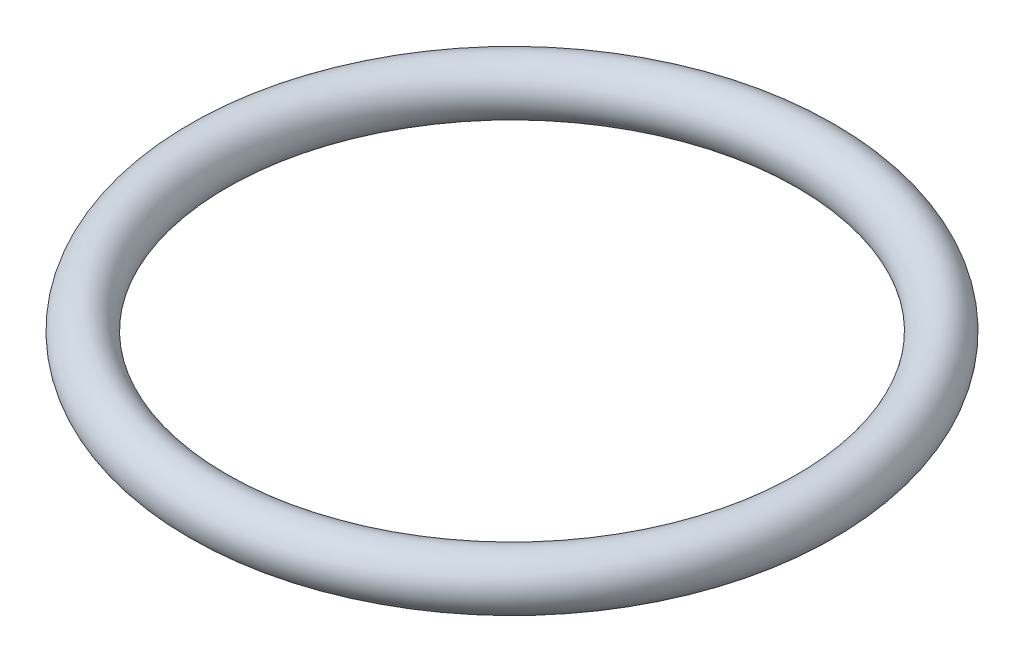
SolidWorks part; units mm, degrees
ref_plane "Face" through (0, 0, 0) normal (0, 0, 1) x (1, 0, 0)
ref_plane "Dessus" through (0, 0, 0) normal (0, 1, 0) x (1, 0, 0)
ref_plane "Droite" through (0, 0, 0) normal (1, 0, 0) x (0, 0, -1)
sketch "Esquisse1" plane through (0, 0, 0) normal (0, 0, 1) x (1, 0, 0)
  line L0 (0, 0) -> (17.5, 0) construction
  line L1 (0, 18.8529) -> (0, -18.8529) construction
  circle A0 centre (17.5, 0) radius 1.5
  dimension "D1" = 19
  dimension "D2" = 3
revolve "Base-Révolution" add sketch "Esquisse1" angle 360 about L1
